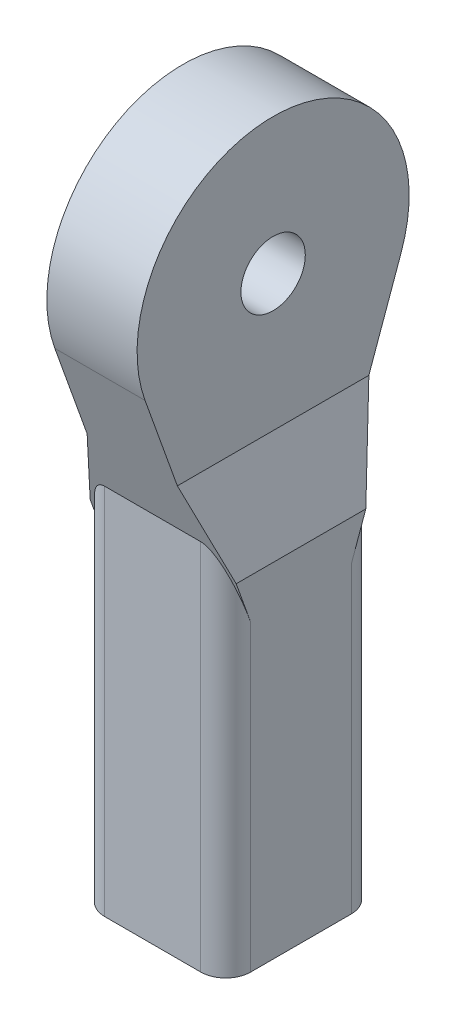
SolidWorks part; units mm, degrees
ref_plane "Front Plane" through (0, 0, 0) normal (0, 0, 1) x (1, 0, 0)
ref_plane "Top Plane" through (0, 0, 0) normal (0, 1, 0) x (1, 0, 0)
ref_plane "Right Plane" through (0, 0, 0) normal (1, 0, 0) x (0, 0, -1)
sketch "Sketch1" plane through (0, 0, 0) normal (1, 0, 0) x (0, 0, -1)
  line L3 (-1.2404, -6.2865) -> (2.976, -6.2865)
  line L5 (-1.2404, -6.2865) -> (-1.2404, 4.1529)
  line L6 (2.976, -6.2865) -> (2.976, 4.1529)
  line L7 (2.976, 4.1529) -> (4.4544, 8.2776)
  line L8 (-1.2404, 4.1529) -> (-2.7188, 8.2776)
  arc A0 (4.4544, 8.2776) -> (-2.7188, 8.2776) centre (0.8678, 9.5631) ccw
  point P0 (0.8678, -6.2865)
  dimension "D3" = 7.62
  dimension "D2" = 15.8496
  dimension "D1" = 4.2164
  dimension "D4" = 10.4394
extrude "Boss-Extrude1" add sketch "Sketch1" along normal blind 4.0894
sketch "Sketch2" plane through (0, -6.2865, 0) normal (0, -1, 0) x (1, 0, 0)
  line L0 (4.0894, 1.2404) -> (4.0894, -2.976) construction
  line L2 (4.0894, 1.2404) -> (0, 1.2404) construction
  circle A0 centre (2.0447, -0.8678) radius 0.9
  point P2 (0, 0)
  point P5 (4.0894, -0.8678)
  point P8 (2.0447, 1.2404)
  dimension "D1" = 1.8
extrude "Cut-Extrude1" cut sketch "Sketch2" against normal blind 2.54
fillet "Fillet1" radius 0.7 4 edges at (0, -1.0668, 1.2404) (0, -1.0668, -2.976) (4.0894, -1.0668, -2.976) (4.0894, -1.0668, 1.2404)
sketch "Sketch3" plane through (0, 0, 0) normal (0, 0, 1) x (1, 0, 0)
  line L0 (3.3083, 13.3731) -> (3.3083, 5.7531)
  line L1 (4.0894, 13.3731) -> (0, 13.3731) construction
  line L2 (0.781, 13.3731) -> (0.781, 5.7531)
  line L3 (3.3083, 5.7531) -> (4.0894, 3.3362)
  line L4 (4.0894, 8.2776) -> (4.0894, 2.1999) construction
  line L5 (0.781, 5.7531) -> (0, 3.3362)
  line L6 (0, 8.2776) -> (0, 2.1999) construction
  line L7 (0.781, 13.3731) -> (-0.8324, 13.3731)
  line L8 (-0.8324, 13.3731) -> (0, 3.3362)
  line L9 (4.0894, 3.3362) -> (5.1183, 13.3731)
  line L10 (5.1183, 13.3731) -> (3.3083, 13.3731)
  line L11 (2.0447, 13.3731) -> (2.0447, -0.806) construction
  dimension "D1" = 7.62
  dimension "D2" = 2.54
  dimension "D3" = 2.5273
extrude "Cut-Extrude2" cut sketch "Sketch3" against normal through all both and the other way through all
sketch "Sketch4" plane through (3.3084, 0, 0) normal (1, 0, 0) x (0, 0, -1)
  circle A0 centre (0.8678, 9.5631) radius 0.9017
  dimension "D1" = 1.8034
extrude "Cut-Extrude3" cut sketch "Sketch4" against normal through all and the other way through all
